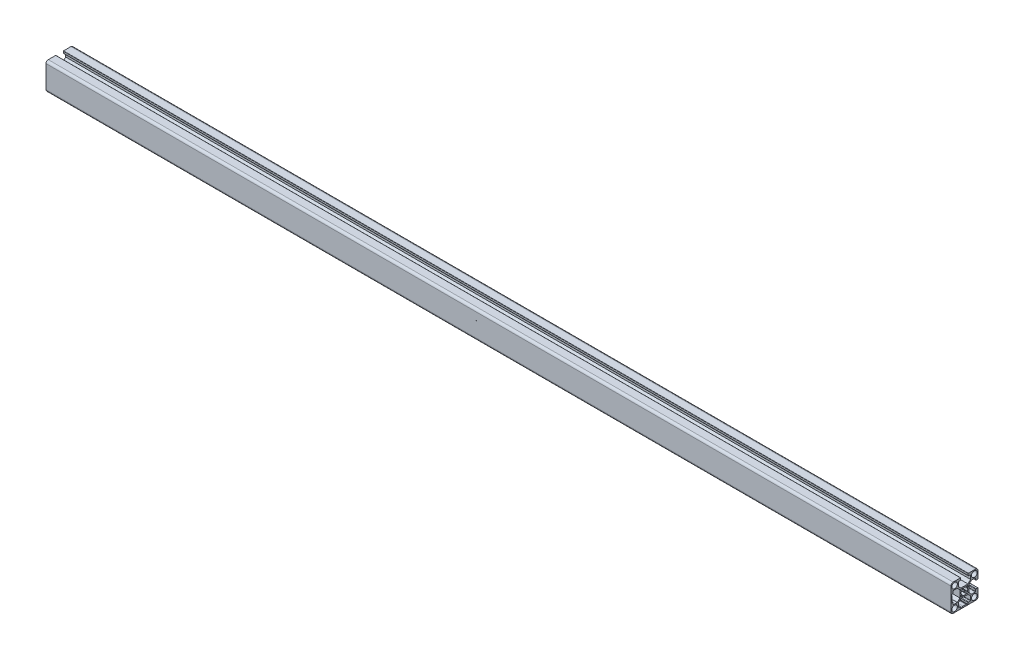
SolidWorks part; units mm, degrees
ref_plane "Front Plane" through (0, 0, 0) normal (0, 0, 1) x (1, 0, 0)
ref_plane "Top Plane" through (0, 0, 0) normal (0, 1, 0) x (1, 0, 0)
ref_plane "Right Plane" through (0, 0, 0) normal (1, 0, 0) x (0, 0, -1)
sketch "Sketch1" plane through (0, 0, 0) normal (0, 0, 1) x (1, 0, 0)
  line L0 (0, 0) -> (1000, 0)
  dimension "D1" = 1000
other "30-sarja 1.0007 30X30 2SS(1)"
ref_plane "Plane1" through (0, 0, 0) normal (1, 0, 0) x (0, 0, -1)
sketch "Model7" plane through (0, 0, 0) normal (1, 0, 0) x (0, 0, -1)
  line L0 (-3.3633, -1.9506) -> (-3.6416, -2.2289)
  line L1 (-3.6416, -2.2289) -> (-3.8647, -3.2786)
  line L2 (-3.2703, -3.8648) -> (-2.2274, -3.6431)
  line L3 (-2.2274, -3.6431) -> (-1.9491, -3.3648)
  line L4 (1.7935, -3.2092) -> (2.2274, -3.6431)
  line L5 (2.2274, -3.6431) -> (3.2703, -3.8648)
  line L6 (3.8647, -3.2786) -> (3.6416, -2.2289)
  line L7 (3.6416, -2.2289) -> (3.3633, -1.9506)
  line L8 (3.3633, 1.9476) -> (3.6416, 2.2259)
  line L9 (3.6416, 2.2259) -> (3.8647, 3.2756)
  line L10 (3.1951, 3.8458) -> (2.2274, 3.6401)
  line L11 (2.2274, 3.6401) -> (1.9491, 3.3618)
  line L12 (-1.9491, 3.3618) -> (-2.2274, 3.6401)
  line L13 (-2.2274, 3.6401) -> (-3.2703, 3.8618)
  line L14 (-3.8647, 3.2756) -> (-3.6416, 2.2259)
  line L15 (-3.6416, 2.2259) -> (-3.3633, 1.9476)
  line L16 (4.6, -12.5015) -> (6.5, -12.5015)
  line L17 (6.8, -12.2015) -> (6.8, -7.8615)
  line L18 (6.8, -7.8615) -> (3.94, -5.0015)
  line L19 (3.94, -5.0015) -> (-3.94, -5.0015)
  line L20 (-3.94, -5.0015) -> (-6.8, -7.8615)
  line L21 (-6.8, -7.8615) -> (-6.8, -12.2015)
  line L22 (-6.5, -12.5015) -> (-4.6, -12.5015)
  line L23 (-4.1, -13.0015) -> (-4.1, -14.7015)
  line L24 (-4.1, -14.7015) -> (-3.8, -14.7015)
  line L25 (-3.8, -14.7015) -> (-3.3322, -14.2337)
  line L26 (-1.5645, -13.5015) -> (1.5645, -13.5015)
  line L27 (3.3323, -14.2338) -> (3.8, -14.7015)
  line L28 (3.8, -14.7015) -> (4.1, -14.7015)
  line L29 (4.1, -14.7015) -> (4.1, -13.0015)
  line L30 (-12.5009, -4.6024) -> (-12.5009, -6.5039)
  line L31 (-12.2009, -6.8039) -> (-7.8609, -6.8039)
  line L32 (-7.8609, -6.8039) -> (-5.0009, -3.9439)
  line L33 (-5.0009, -3.9439) -> (-5.0009, 3.9361)
  line L34 (-5.0009, 3.9361) -> (-7.8609, 6.7961)
  line L35 (-7.8609, 6.7961) -> (-12.2009, 6.7961)
  line L36 (-12.5066, 6.4902) -> (-12.5066, 4.5917)
  line L37 (-13.0058, 4.0917) -> (-14.6955, 4.0917)
  line L38 (-14.6955, 4.0917) -> (-14.6955, 3.7964)
  line L39 (-14.6955, 3.7964) -> (-14.2278, 3.3287)
  line L40 (-13.505, 1.5629) -> (-13.505, -1.5671)
  line L41 (-14.2317, -3.3337) -> (-14.6995, -3.8015)
  line L42 (-14.6995, -3.8015) -> (-14.7, -4.1015)
  line L43 (-14.7, -4.1015) -> (-13.0009, -4.1015)
  line L44 (-4.1, 12.9985) -> (-4.1, 14.6985)
  line L45 (-6.5, 12.4985) -> (-4.6, 12.4985)
  line L46 (-6.8, 7.8585) -> (-6.8, 12.1985)
  line L47 (-3.94, 4.9985) -> (-6.8, 7.8585)
  line L48 (3.94, 4.9985) -> (-3.94, 4.9985)
  line L49 (6.8, 7.8585) -> (3.94, 4.9985)
  line L50 (6.8, 12.1985) -> (6.8, 7.8585)
  line L51 (4.6, 12.5) -> (6.5, 12.5)
  line L52 (4.1, 14.7) -> (4.1, 13)
  line L53 (12.5, 15) -> (4.4, 15)
  line L54 (15, 4.4) -> (15, 12.5)
  line L55 (13, 4.0985) -> (14.7, 4.0985)
  line L56 (12.5, 6.5) -> (12.5, 4.5985)
  line L57 (7.86, 6.8) -> (12.2, 6.8)
  line L58 (5, 3.94) -> (7.86, 6.8)
  line L59 (5, -3.94) -> (5, 3.94)
  line L60 (7.86, -6.8) -> (5, -3.94)
  line L61 (12.1993, -6.8) -> (7.86, -6.8)
  line L62 (12.4993, -4.6015) -> (12.4993, -6.5)
  line L63 (14.7, -4.1015) -> (12.9993, -4.1015)
  line L64 (15, -12.5015) -> (15, -4.4015)
  line L65 (-12.5, -15) -> (12.5, -15)
  line L66 (-15, 12.4985) -> (-15, -12.5015)
  line L67 (-4.4, 14.9985) -> (-12.5, 14.9985)
  arc A0 (-3.8647, -3.2786) -> (-3.2703, -3.8648) centre (-3.3742, -3.3757) ccw
  arc A1 (-1.6059, -3.3071) -> (-1.9491, -3.3648) centre (-1.7369, -3.5769) ccw
  arc A2 (-1.6059, -3.3071) -> (1.7935, -3.2092) centre (0, 0) ccw
  arc A3 (3.2703, -3.8648) -> (3.8647, -3.2786) centre (3.3742, -3.3757) ccw
  arc A4 (3.3056, -1.6073) -> (3.3633, -1.9506) centre (3.5754, -1.7384) ccw
  arc A5 (3.3056, -1.6073) -> (3.2949, 1.6292) centre (0, 0) ccw
  arc A6 (3.3633, 1.9476) -> (3.2949, 1.6292) centre (3.5754, 1.7355) ccw
  arc A7 (3.8647, 3.2756) -> (3.1951, 3.8458) centre (3.3756, 3.3795) ccw
  arc A8 (1.6058, 3.3041) -> (1.9491, 3.3618) centre (1.7369, 3.5739) ccw
  arc A9 (1.6058, 3.3041) -> (-1.6059, 3.3041) centre (0, 0) ccw
  arc A10 (-1.9491, 3.3618) -> (-1.6059, 3.3041) centre (-1.7369, 3.5739) ccw
  arc A11 (-3.2703, 3.8618) -> (-3.8647, 3.2756) centre (-3.3742, 3.3727) ccw
  arc A12 (-3.2949, 1.6292) -> (-3.3633, 1.9476) centre (-3.5754, 1.7355) ccw
  arc A13 (-3.2949, 1.6292) -> (-3.3056, -1.6073) centre (0, 0) ccw
  arc A14 (-3.3633, -1.9506) -> (-3.3056, -1.6073) centre (-3.5754, -1.7384) ccw
  circle A15 centre (10.9, -10.9015) radius 3.1
  circle A16 centre (-10.9, 10.8985) radius 3.1
  arc A17 (4.6, -12.5015) -> (4.1, -13.0015) centre (4.6, -13.0015) ccw
  arc A18 (6.5, -12.5015) -> (6.8, -12.2015) centre (6.5, -12.2015) ccw
  arc A19 (-6.8, -12.2015) -> (-6.5, -12.5015) centre (-6.5, -12.2015) ccw
  arc A20 (-4.1, -13.0015) -> (-4.6, -12.5015) centre (-4.6, -13.0015) ccw
  arc A21 (-1.5645, -13.5015) -> (-3.3322, -14.2337) centre (-1.5645, -16.0015) ccw
  arc A22 (3.3323, -14.2338) -> (1.5645, -13.5015) centre (1.5645, -16.0015) ccw
  arc A23 (-12.5009, -4.6024) -> (-13.0009, -4.1015) centre (-13.0009, -4.6015) ccw
  arc A24 (-12.5009, -6.5039) -> (-12.2009, -6.8039) centre (-12.2009, -6.5039) ccw
  arc A25 (-12.2009, 6.7961) -> (-12.5066, 6.4902) centre (-12.2067, 6.4962) ccw
  arc A26 (-13.0058, 4.0917) -> (-12.5066, 4.5917) centre (-13.0066, 4.5917) ccw
  arc A27 (-13.505, 1.5629) -> (-14.2278, 3.3287) centre (-16.005, 1.5704) ccw
  arc A28 (-14.2317, -3.3337) -> (-13.505, -1.5671) centre (-16.005, -1.5715) ccw
  arc A29 (-4.6, 12.4985) -> (-4.1, 12.9985) centre (-4.6, 12.9985) ccw
  arc A30 (-6.5, 12.4985) -> (-6.8, 12.1985) centre (-6.5, 12.1985) ccw
  arc A31 (6.8, 12.1985) -> (6.5, 12.5) centre (6.5, 12.2) ccw
  arc A32 (4.1, 13) -> (4.6, 12.5) centre (4.6, 13) ccw
  arc A33 (4.4, 15) -> (4.1, 14.7) centre (4.4, 14.7) ccw
  arc A34 (15, 12.5) -> (12.5, 15) centre (12.5, 12.5) ccw
  arc A35 (14.7, 4.0985) -> (15, 4.4) centre (14.7, 4.3985) ccw
  arc A36 (12.5, 4.5985) -> (13, 4.0985) centre (13, 4.5985) ccw
  arc A37 (12.5, 6.5) -> (12.2, 6.8) centre (12.2, 6.5) ccw
  arc A38 (12.1993, -6.8) -> (12.4993, -6.5) centre (12.1993, -6.5) ccw
  arc A39 (12.9993, -4.1015) -> (12.4993, -4.6015) centre (12.9993, -4.6015) ccw
  arc A40 (15, -4.4015) -> (14.7, -4.1015) centre (14.7, -4.4015) ccw
  arc A41 (12.5, -15) -> (15, -12.5015) centre (12.5, -12.5) ccw
  arc A42 (-15, -12.5015) -> (-12.5, -15) centre (-12.5, -12.5) ccw
  arc A43 (-12.5, 14.9985) -> (-15, 12.4985) centre (-12.5, 12.4985) ccw
  arc A44 (-4.1, 14.6985) -> (-4.4, 14.9985) centre (-4.4, 14.6985) ccw
  circle A45 centre (10.9, 10.8985) radius 3.1
  circle A46 centre (-10.9, -10.9015) radius 3.1
  point P159 (-15, -0.0015)
  point P160 (0, 0)
  point P161 (0, -15.0015)
  point P162 (-15, 14.9985)
  point P163 (0, 14.9985)
  point P164 (15, 15)
  point P165 (15, 0)
  point P166 (15, -15)
  point P167 (-15, -15)
  point P168 (0, 0)
